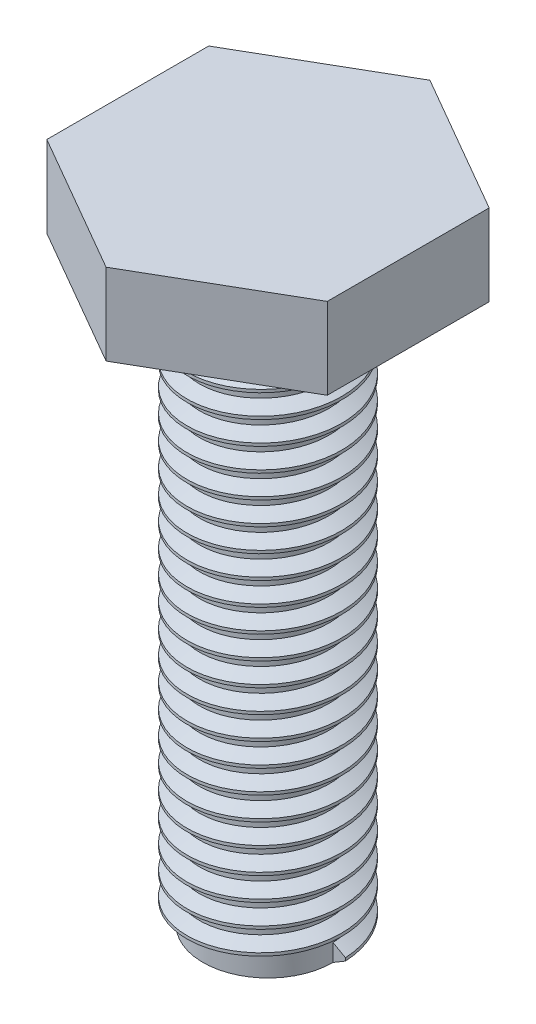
SolidWorks part; units mm, degrees
ref_plane "Front Plane" through (0, 0, 0) normal (0, 0, 1) x (1, 0, 0)
ref_plane "Top Plane" through (0, 0, 0) normal (0, 1, 0) x (1, 0, 0)
ref_plane "Right Plane" through (0, 0, 0) normal (1, 0, 0) x (0, 0, -1)
sketch "Sketch1" plane through (0, 0, 0) normal (0, 1, 0) x (1, 0, 0)
  circle A0 centre (0, 0) radius 2.54
  dimension "D1" = 5.08
extrude "Boss-Extrude1" add sketch "Sketch1" along normal blind 22.225 contours A0
sketch "Sketch2" plane through (0, 22.225, 0) normal (0, 1, 0) x (1, 0, 0)
  line L0 (0, 0) -> (0, 1.6416) construction
  line L2 (0, -6.3209) -> (5.4741, -3.1604)
  line L3 (0, 0) -> (-1.9078, 0) construction
  line L4 (5.4741, -3.1604) -> (5.4741, 3.1604)
  line L5 (5.4741, 3.1604) -> (0, 6.3209)
  line L6 (0, 6.3209) -> (-5.4741, 3.1604)
  line L7 (-5.4741, 3.1604) -> (-5.4741, -3.1604)
  line L8 (-5.4741, -3.1604) -> (0, -6.3209)
  circle A0 centre (0, 0) radius 5.4741 construction
  circle A1 centre (0, 0) radius 2.54 construction
extrude "Boss-Extrude2" add sketch "Sketch2" along normal blind 3.175
thread "Thread1" pitch 0.9071 start angle 0, offset 0, length 22.225, pitch 0.9071, diameter 5.08
ref_plane "Plane3" through (2.54, 0, 0) normal (0, 0, 1) x (0.9998, 0.0175, 0)
sketch "Thread Profile3" plane through (2.54, 0, 0) normal (0, 0, 1) x (0.9998, 0.0175, 0)
  line L0 (0, 0) -> (0, 0.9071) construction
  line L1 (0, 0) -> (0.491, 0.2835)
  line L2 (0.491, 0.2835) -> (0.491, 0.3969)
  line L3 (0.491, 0.3969) -> (0, 0.6804)
  line L4 (0.491, 0.3402) -> (0, 0.3402) construction
  line L11 (0, 0) -> (0, 0.6804)
  point P2 (0, 0)
  dimension "Pitch" = 0.9071
  dimension "Profile_Angle" = 60
  dimension "Profile_Land" = 0.1134
  dimension "Profile_Height" = 0.491
